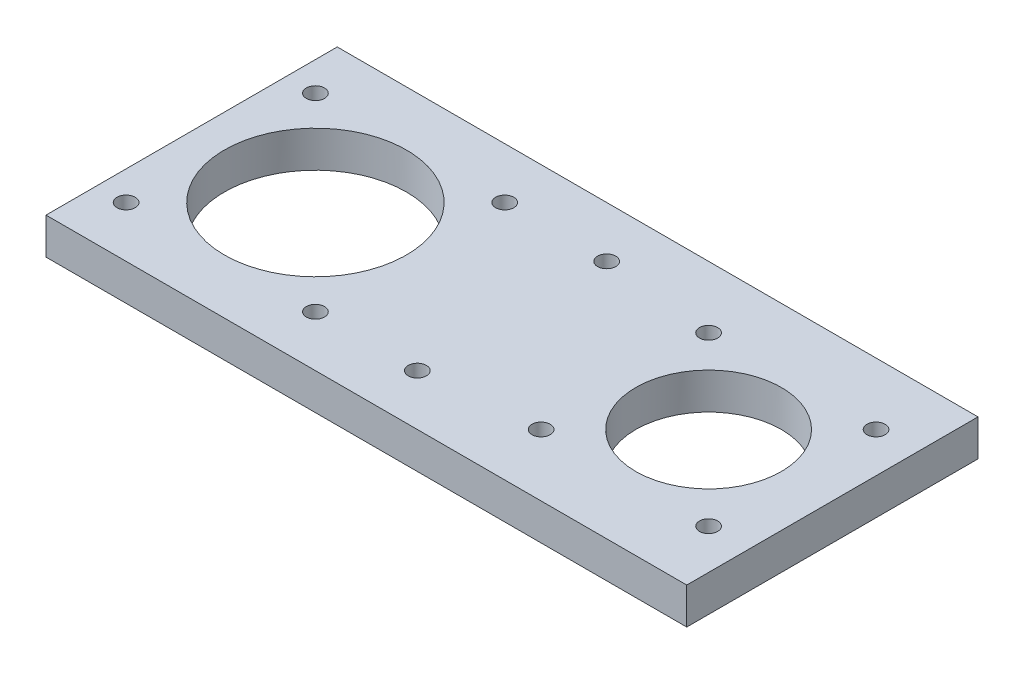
SolidWorks part; units mm, degrees
ref_plane "Спереди" through (0, 0, 0) normal (0, 0, 1) x (1, 0, 0)
ref_plane "Сверху" through (0, 0, 0) normal (0, 1, 0) x (1, 0, 0)
ref_plane "Справа" through (0, 0, 0) normal (1, 0, 0) x (0, 0, -1)
sketch "Эскиз1" plane through (0, 0, 0) normal (0, 1, 0) x (1, 0, 0)
  line L1 (0, 0) -> (88, 0)
  line L2 (0, 0) -> (0, 40)
  line L3 (0, 40) -> (88, 40)
  line L4 (88, 0) -> (88, 40)
  dimension "D1" = 40
  dimension "D2" = 88
extrude "Бобышка-Вытянуть1" add sketch "Эскиз1" along normal blind 5
sketch "Эскиз2" plane through (0, 5, 0) normal (0, 1, 0) x (1, 0, 0)
  line L1 (0, 40) -> (0, 0) construction
  circle A0 centre (44, 33) radius 1.25
  circle A1 centre (44, 7) radius 1.25
  point P4 (0, 20)
  dimension "D1" = 26
  dimension "D3" = 2.5
  dimension "D4" = 2.5
  dimension "D2" = 13
  dimension "D5" = 44
  dimension "D6" = 44
extrude "Вырез-Вытянуть1" cut sketch "Эскиз2" against normal blind 5
sketch "Эскиз3" plane through (0, 5, 0) normal (0, 1, 0) x (1, 0, 0)
  line L0 (0, 0) -> (88, 0) construction
  circle A0 centre (17, 20) radius 12.5
  circle A1 centre (44, 33) radius 1.25 construction
  dimension "D2" = 25
  dimension "D3" = 27
  dimension "D1" = 20
extrude "Вырез-Вытянуть2" cut sketch "Эскиз3" against normal blind 10
sketch "Эскиз4" plane through (0, 5, 0) normal (0, 1, 0) x (1, 0, 0)
  circle A0 centre (4, 33) radius 1.25
  circle A1 centre (17, 20) radius 12.5 construction
  dimension "D2" = 13
  dimension "D3" = 2.5
  dimension "D1" = 13
extrude "Вырез-Вытянуть3" cut sketch "Эскиз4" against normal blind 10
pattern_circular "Круговой массив1" count 4 over 360 about axis through (17, 0, -20) along (0, 1, 0) of "Вырез-Вытянуть3"
sketch "Эскиз5" plane through (0, 5, 0) normal (0, 1, 0) x (1, 0, 0)
  line L0 (0, 0) -> (88, 0) construction
  circle A0 centre (71, 20) radius 10
  circle A1 centre (44, 33) radius 1.25 construction
  dimension "D2" = 20
  dimension "D3" = 27
  dimension "D1" = 20
extrude "Вырез-Вытянуть4" cut sketch "Эскиз5" against normal blind 10
sketch "Эскиз6" plane through (0, 5, 0) normal (0, 1, 0) x (1, 0, 0)
  circle A0 centre (59.5, 31.5) radius 1.25
  circle A1 centre (71, 20) radius 10 construction
  dimension "D2" = 11.5
  dimension "D3" = 2.5
  dimension "D1" = 11.5
extrude "Вырез-Вытянуть5" cut sketch "Эскиз6" against normal blind 10
pattern_circular "Круговой массив2" count 4 over 360 about axis through (71, 0, -20) along (0, 1, 0) of "Вырез-Вытянуть5"
